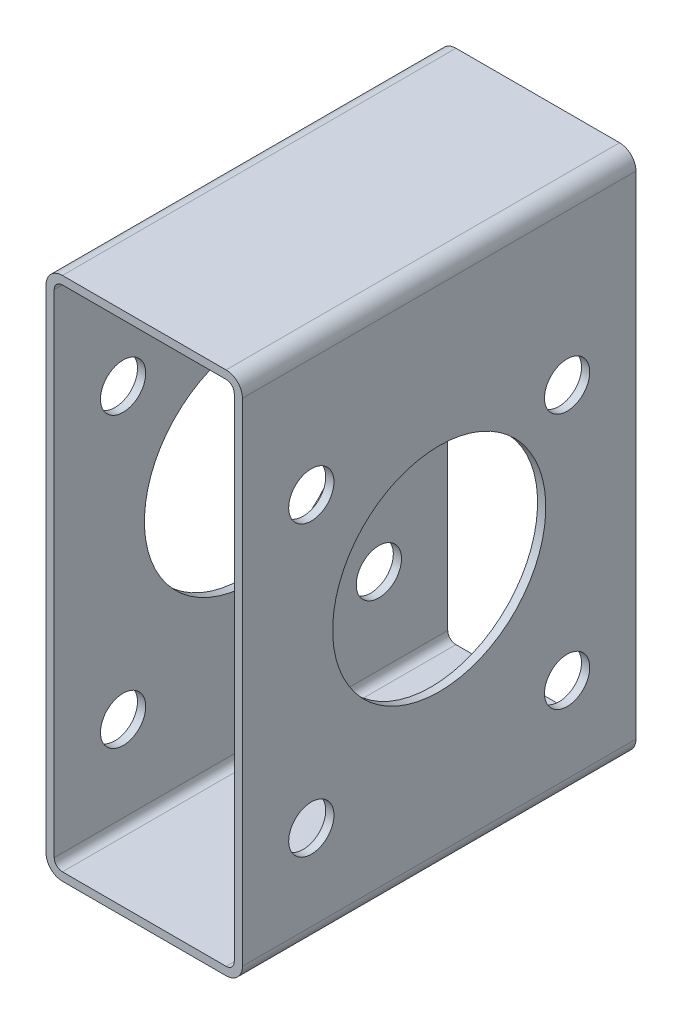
SolidWorks part; units mm, degrees
ref_plane "Plane1" through (0, 0, 0) normal (0, 0, 1) x (1, 0, 0)
ref_plane "Plane2" through (0, 0, 0) normal (0, 1, 0) x (1, 0, 0)
ref_plane "Plane3" through (0, 0, 0) normal (1, 0, 0) x (0, 0, -1)
sketch "Sketch1" plane through (0, 0, 0) normal (0, 0, 1) x (1, 0, 0)
  line L0 (-34.925, -82.55) -> (-34.925, 107.95)
  line L1 (-31.75, -88.9) -> (31.623, -88.9)
  line L2 (-38.1, -82.55) -> (-38.1, 107.95)
  line L3 (-31.75, 114.3) -> (31.623, 114.3)
  line L4 (37.973, -82.55) -> (37.973, 107.95)
  line L5 (-31.75, 111.125) -> (31.623, 111.125)
  line L6 (34.798, -82.55) -> (34.798, 107.95)
  line L7 (-31.75, -85.725) -> (31.623, -85.725)
  arc A0 (-31.75, 111.125) -> (-34.925, 107.95) centre (-31.75, 107.95) ccw
  arc A1 (34.798, 107.95) -> (31.623, 111.125) centre (31.623, 107.95) ccw
  arc A2 (34.798, -82.55) -> (31.623, -85.725) centre (31.623, -82.55) cw
  arc A3 (-34.925, -82.55) -> (-31.75, -85.725) centre (-31.75, -82.55) ccw
  arc A4 (-38.1, -82.55) -> (-31.75, -88.9) centre (-31.75, -82.55) ccw
  arc A5 (37.973, -82.55) -> (31.623, -88.9) centre (31.623, -82.55) cw
  arc A6 (37.973, 107.95) -> (31.623, 114.3) centre (31.623, 107.95) ccw
  arc A7 (-31.75, 114.3) -> (-38.1, 107.95) centre (-31.75, 107.95) ccw
  dimension "D1" = 3.175
  dimension "D2" = 6.35
  dimension "D3" = 76.073
  dimension "D4" = 203.2
extrude "CHANNEL" add sketch "Sketch1" along normal blind 152.4
sketch "Sketch2" plane through (37.973, 0, 0) normal (1, 0, 0) x (0, 0, -1)
  line L0 (-76.2, 114.3) -> (-76.2, -88.9) construction
  line L1 (-152.4, 114.3) -> (0, 114.3) construction
  line L2 (-152.4, -88.9) -> (0, -88.9) construction
  line L3 (-152.4, 12.7) -> (0, 0) construction
  line L4 (-152.4, -82.55) -> (-152.4, 107.95) construction
  circle A0 centre (-76.2, 12.7) radius 41.275
  circle A1 centre (-125.73, 62.23) radius 8.763
  circle A2 centre (-26.67, 49.53) radius 8.763
  circle A3 centre (-26.67, -49.53) radius 8.763
  circle A4 centre (-125.73, -49.53) radius 8.763
  dimension "D1" = 49.53
  dimension "D2" = 49.53
  dimension "D3" = 82.55
extrude "HOLES1" cut sketch "Sketch2" against normal up to next
sketch "Sketch4" plane through (-38.1, 0, 0) normal (-1, 0, 0) x (0, 0, 1)
  line L0 (76.2, 114.3) -> (76.2, -88.9) construction
  line L1 (152.4, 114.3) -> (0, 114.3) construction
  line L2 (152.4, -88.9) -> (0, -88.9) construction
  circle A0 centre (76.2, 12.7) radius 41.275
  circle A1 centre (26.67, 49.53) radius 8.763
  circle A2 centre (125.73, 62.23) radius 8.763
  circle A3 centre (26.67, -49.53) radius 8.763
  circle A4 centre (125.73, -49.53) radius 8.763
  circle A5 centre (76.2, 12.7) radius 41.275 construction
extrude "HOLES2" cut sketch "Sketch4" against normal up to next
